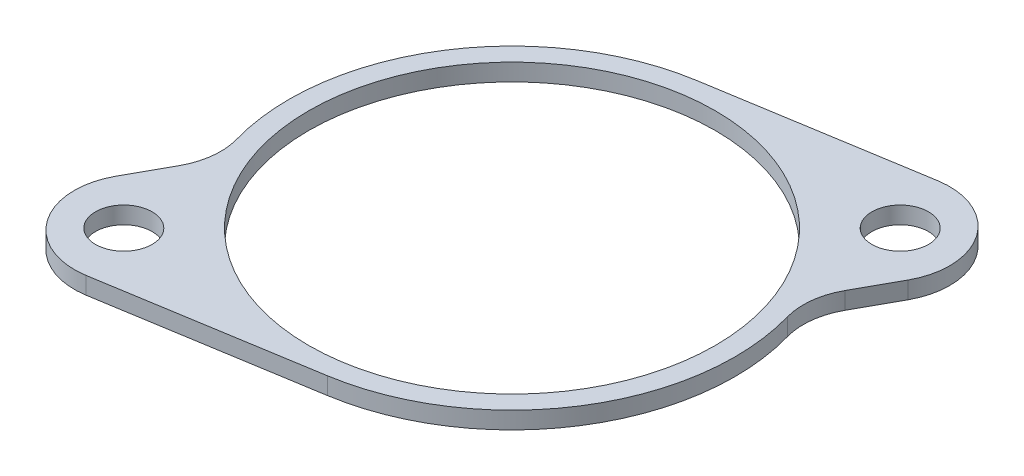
SolidWorks part; units mm, degrees
ref_plane "Front Plane" through (0, 0, 0) normal (0, 0, 1) x (1, 0, 0)
ref_plane "Top Plane" through (0, 0, 0) normal (0, 1, 0) x (1, 0, 0)
ref_plane "Right Plane" through (0, 0, 0) normal (1, 0, 0) x (0, 0, -1)
sketch "Sketch1" plane through (0, 0, 0) normal (0, 1, 0) x (1, 0, 0)
  line L0 (-11.3137, -11.3137) -> (11.3137, 11.3137) construction
  line L1 (0, 0) -> (11.85, 0) construction
  line L2 (12, 5) -> (18.1333, 16.1213)
  line L3 (18.1333, 16.1213) -> (-2.0877, 12.8313)
  line L4 (-12, -5) -> (-18.1333, -16.1213)
  line L5 (-18.1333, -16.1213) -> (2.0877, -12.8313)
  line L6 (11.3137, 11.3137) -> (10.7276, 14.9163) construction
  line L7 (11.3137, 11.3137) -> (14.5099, 9.551) construction
  line L8 (-11.3137, -11.3137) -> (-14.5099, -9.551) construction
  line L9 (-11.3137, -11.3137) -> (-10.7276, -14.9163) construction
  arc A0 (-2.0877, 12.8313) -> (-12, -5) centre (0, 0) ccw
  circle A1 centre (0, 0) radius 11.85
  circle A2 centre (0, 0) radius 16 construction
  circle A3 centre (11.3137, 11.3137) radius 1.65
  circle A4 centre (-11.3137, -11.3137) radius 1.65
  arc A5 (2.0877, -12.8313) -> (12, 5) centre (0, 0) ccw
  point P1 (-12.4924, -3.5973)
  point P11 (0, 0)
  point P20 (12.9981, 0.2215)
  point P23 (12.8733, -1.8104)
  point P24 (12.2432, 4.3709)
  dimension "D1" = 26
  dimension "D2" = 23.7
  dimension "D3" = 32
  dimension "D4" = 3.3
  dimension "D5" = 45
  dimension "D6" = 3.65
  dimension "D7" = 5
  dimension "D8" = 5
extrude "Boss-Extrude1" add sketch "Sketch1" along normal blind 1
fillet "Fillet1" radius 4 4 edges at (18.1333, 0.5, -16.1213) (-18.1333, 0.5, 16.1213) (-12, 0.5, 5) (12, 0.5, -5)
